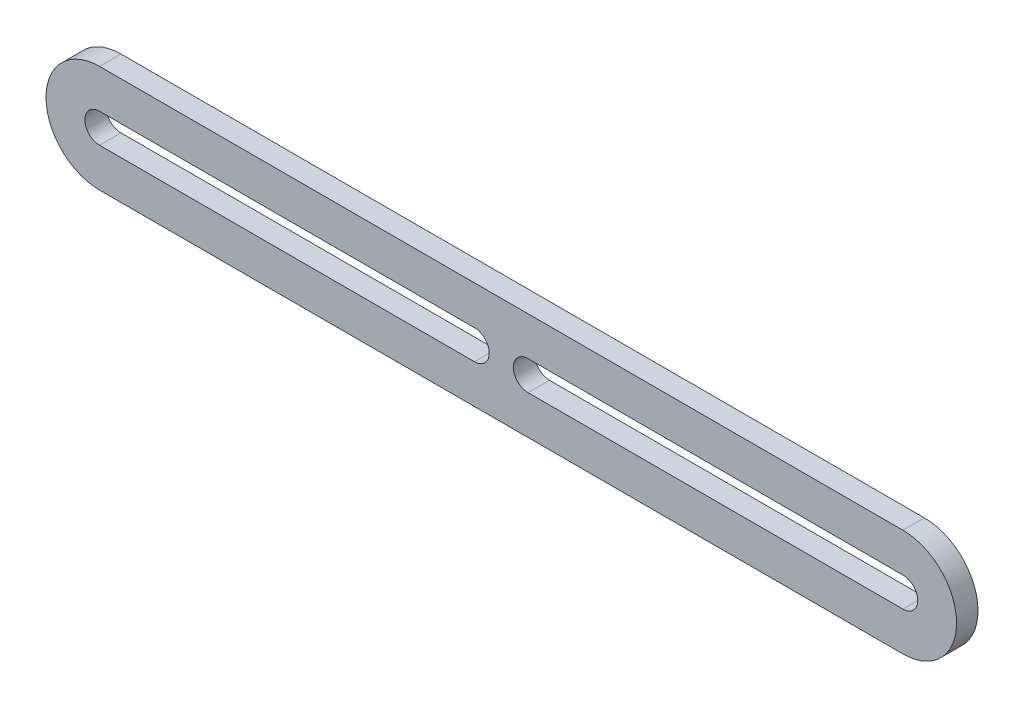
SolidWorks part; units mm, degrees
ref_plane "Ebene vorne" through (0, 0, 0) normal (0, 0, 1) x (1, 0, 0)
ref_plane "Ebene oben" through (0, 0, 0) normal (0, 1, 0) x (1, 0, 0)
ref_plane "Ebene rechts" through (0, 0, 0) normal (1, 0, 0) x (0, 0, -1)
sketch "Skizze1" plane through (0, 0, 0) normal (0, 0, 1) x (1, 0, 0)
  line L0 (0, 82.4918) -> (0, -82.7541) construction
  line L1 (-91.541, 0) -> (89.9672, 0) construction
  line L2 (0, 20) -> (150, 20)
  line L3 (0, 0) -> (150, 0)
  line L4 (0, 10) -> (70, 10) construction
  line L7 (0, 12.75) -> (70, 12.75)
  line L8 (0, 7.25) -> (70, 7.25)
  line L9 (75, 20) -> (75, 0) construction
  line L11 (150, 10) -> (80, 10) construction
  line L12 (150, 12.75) -> (80, 12.75)
  line L13 (150, 7.25) -> (80, 7.25)
  arc A0 (150, 20) -> (150, 0) centre (150, 10) cw
  arc A1 (0, 0) -> (0, 20) centre (0, 10) cw
  arc A6 (0, 12.75) -> (0, 7.25) centre (0, 10) ccw
  arc A7 (70, 7.25) -> (70, 12.75) centre (70, 10) ccw
  arc A8 (150, 12.75) -> (150, 7.25) centre (150, 10) cw
  arc A9 (80, 7.25) -> (80, 12.75) centre (80, 10) cw
  point P11 (35, 10)
  point P19 (75, 10)
  point P21 (115, 10)
  dimension "D3" = 5.5
  dimension "D4" = 5
  dimension "D1" = 150
  dimension "D2" = 20
extrude "Aufsatz-Linear austragen1" add sketch "Skizze1" along normal blind 4
